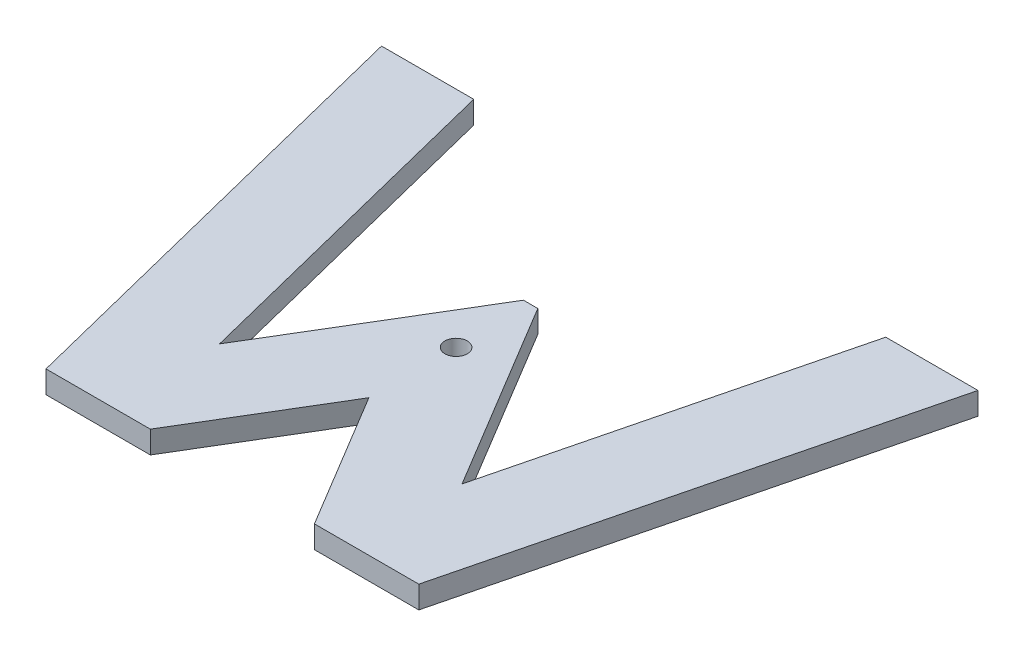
SolidWorks part; units mm, degrees
ref_plane "Front" through (0, 0, 0) normal (0, 0, 1) x (1, 0, 0)
ref_plane "Top" through (0, 0, 0) normal (0, 1, 0) x (1, 0, 0)
ref_plane "Right" through (0, 0, 0) normal (1, 0, 0) x (0, 0, -1)
sketch "Sketch1" plane through (0, 0, 0) normal (0, 1, 0) x (1, 0, 0)
  line L0 (12.3693, 60) -> (23.7352, 14.5363)
  line L1 (15, 0) -> (29, 0)
  line L2 (51, 0) -> (65, 0)
  line L3 (0, 60) -> (12.3693, 60)
  line L7 (67.6307, 60) -> (56.2648, 14.5363)
  line L8 (0, 60) -> (15, 0)
  line L9 (80, 60) -> (65, 0)
  line L10 (68.3583, 62.9104) -> (53.3583, 2.9104) construction
  line L11 (11.6417, 62.9104) -> (26.6417, 2.9104) construction
  line L12 (67.6307, 60) -> (80, 60)
  line L13 (54.7143, -6.1809) -> (30.6773, 33.8191) construction
  line L14 (65, 0) -> (40.963, 40) construction
  line L15 (51, 0) -> (40, 18.3051)
  line L16 (29, 0) -> (40, 18.3051)
  line L17 (23.7352, 14.5363) -> (39.037, 40)
  line L23 (39.037, 40) -> (40.963, 40)
  line L25 (56.2648, 14.5363) -> (40.963, 40)
  circle A0 centre (40, 30) radius 1.5
  dimension "D1" = 60
  dimension "D3" = 3
  dimension "D4" = 30
  dimension "D5" = 40
  dimension "D6" = 14
  dimension "D13" = 14
  dimension "D14" = 40
  dimension "D2" = 80
  dimension "D7" = 12
  dimension "D8" = 12
  dimension "D9" = 12
  dimension "D10" = 12
  dimension "D11" = 15
  dimension "D12" = 15
  dimension "D15" = 40
extrude "Extrude1" add sketch "Sketch1" along normal blind 3
